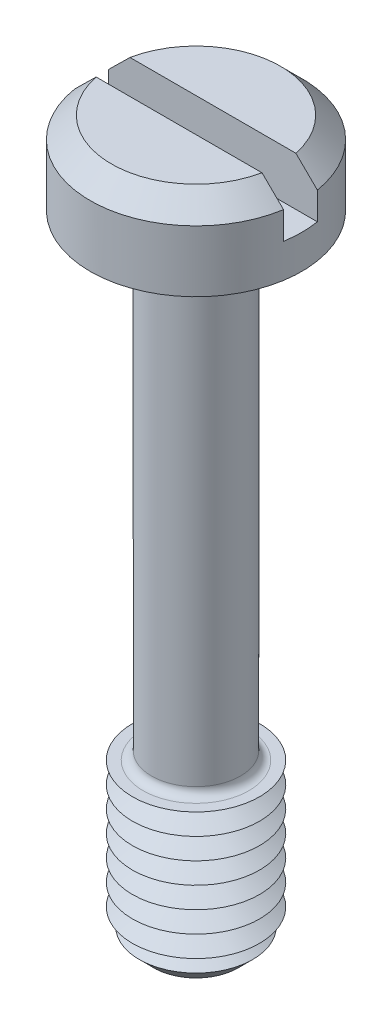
SolidWorks part; units mm, degrees
ref_plane "Front Plane" through (0, 0, 0) normal (0, 0, 1) x (1, 0, 0)
ref_plane "Top Plane" through (0, 0, 0) normal (0, 1, 0) x (1, 0, 0)
ref_plane "Right Plane" through (0, 0, 0) normal (1, 0, 0) x (0, 0, -1)
sketch "Sketch1" plane through (0, 0, 0) normal (0, 1, 0) x (1, 0, 0)
  circle A0 centre (0, 0) radius 5
  dimension "D1" = 10
extrude "Boss-Extrude1" add sketch "Sketch1" along normal blind 3.9
sketch "Sketch2" plane through (0, 0, 0) normal (0, -1, 0) x (1, 0, 0)
  circle A0 centre (0, 0) radius 2.1
  dimension "D1" = 4.2
extrude "Boss-Extrude2" add sketch "Sketch2" along normal blind 30
sketch "Sketch3" plane through (0, -30, 0) normal (0, -1, 0) x (1, 0, 0)
  circle A0 centre (0, 0) radius 3
  dimension "D1" = 6
extrude "Boss-Extrude3" add sketch "Sketch3" against normal blind 7.5
chamfer "Chamfer1" distance 1 angle 45 1 edges at (0, -30, -3)
sketch "Sketch4" plane through (0, 0, 0) normal (1, 0, 0) x (0, 0, -1)
  line L0 (0, -6.5871) -> (0, -12.0372) construction
sketch "Sketch5" plane through (0, 0, 0) normal (1, 0, 0) x (0, 0, -1)
  line L0 (-3, -22.5) -> (-2.134, -23)
  line L1 (-2.134, -23) -> (-3, -23.5)
  line L2 (-3, -22.5) -> (-3, -29) construction
  line L3 (-3, -23.5) -> (-3, -22.5)
  dimension "D1" = 1
revolve "Cut-Revolve1" cut sketch "Sketch5" angle 360 about L0
pattern_linear "LPattern1" count 7 spacing 1 along (0, -1, 0) of "Cut-Revolve1"
fillet "Fillet1" radius 0.4 2 edges at (0, -22.5, -2.1) (0, 0, -2.1)
chamfer "Chamfer2" distance 1 angle 45 1 edges at (0, 3.9, 5)
sketch "Sketch6" plane through (0, 3.9, 0) normal (0, 1, 0) x (1, 0, 0)
  line L1 (5, -0.8) -> (-5, -0.8)
  line L2 (5, -0.8) -> (5, 0.8)
  line L3 (5, 0.8) -> (-5, 0.8)
  line L4 (-5, -0.8) -> (-5, 0.8)
  line L5 (5, -0.8) -> (-5, 0.8) construction
  line L6 (5, 0.8) -> (-5, -0.8) construction
  circle A0 centre (0, 0) radius 5 construction
  point P0 (0, 0)
  dimension "D1" = 1.6
extrude "Cut-Extrude1" cut sketch "Sketch6" against normal blind 2.3
